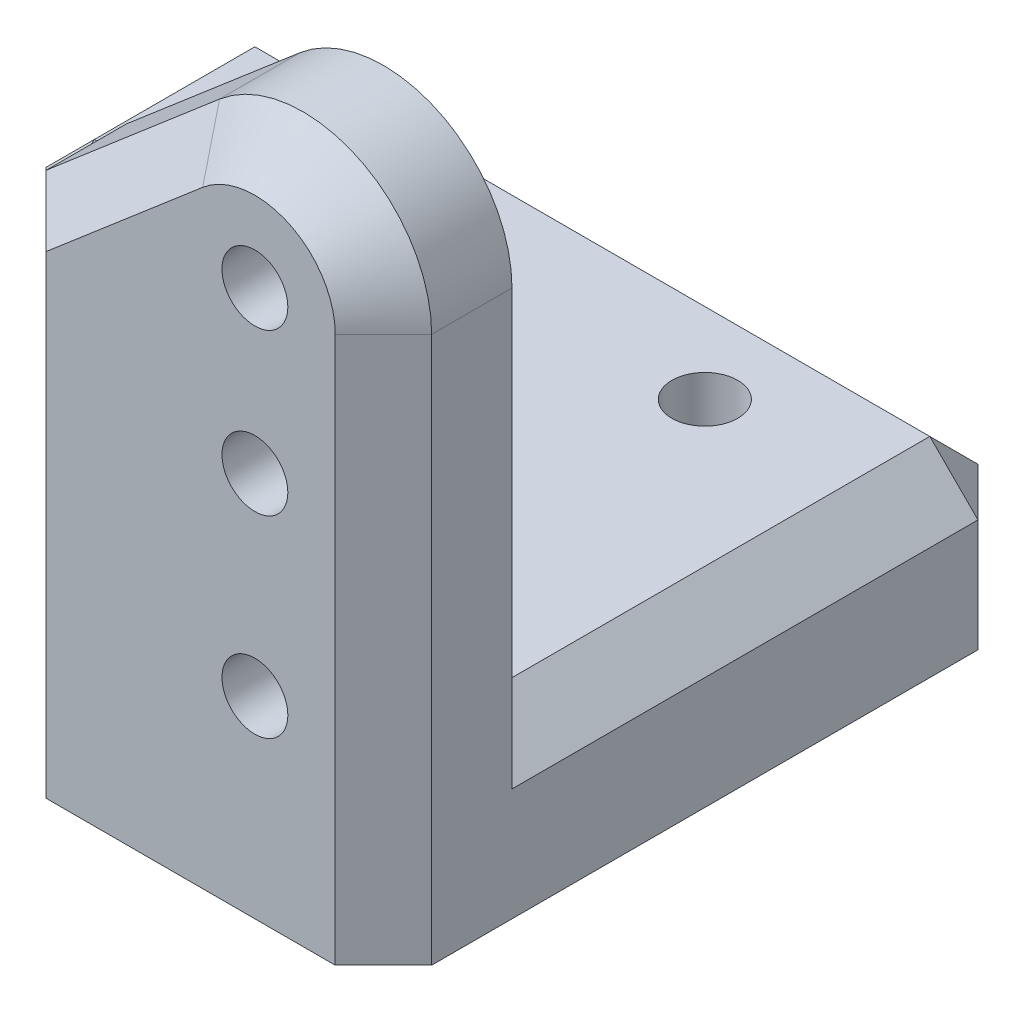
SolidWorks part; units mm, degrees
ref_plane "Plano frontal" through (0, 0, 0) normal (0, 0, 1) x (1, 0, 0)
ref_plane "Plano superior" through (0, 0, 0) normal (0, 1, 0) x (1, 0, 0)
ref_plane "Plano direito" through (0, 0, 0) normal (1, 0, 0) x (0, 0, -1)
sketch "Esboço1" plane through (0, 0, 0) normal (0, 0, 1) x (1, 0, 0)
  line L0 (0, 0) -> (0, 12)
  line L1 (0, 12) -> (9.4001, 20.0398)
  line L4 (16, 17) -> (16, 4)
  line L5 (16, 4) -> (16, 0)
  line L6 (16, 0) -> (0, 0)
  arc A0 (9.4001, 20.0398) -> (16, 17) centre (12, 17) cw
  point P19 (12, 17)
  dimension "D1" = 4
  dimension "D2" = 16
  dimension "D3" = 12
  dimension "D4" = 16
  dimension "D5" = 4
  dimension "D6" = 17
extrude "Ressalto-extrusão1" add sketch "Esboço1" along normal blind 20
sketch "Esboço2" plane through (16, 0, 0) normal (1, 0, 0) x (0, 0, -1)
  line L0 (-20, 0) -> (-20, 5) construction
  line L1 (-20, 5) -> (0, 5) construction
  line L4 (0, 5) -> (-16, 5)
  line L5 (0, 5) -> (0, 21)
  line L6 (0, 21) -> (-16, 21)
  line L7 (-16, 5) -> (-16, 21)
  line L8 (0, 21) -> (-20, 21) construction
  line L9 (0, 0) -> (0, 17) construction
  dimension "D1" = 16
  dimension "D2" = 5
extrude "Corte-extrusão1" cut sketch "Esboço2" against normal blind 20
sketch "Esboço3" plane through (0, 0, 20) normal (0, 0, 1) x (1, 0, 0)
  line L0 (0, 0) -> (4, 0)
  line L1 (0, 0) -> (16, 0) construction
  line L2 (4, 0) -> (4, 15.4212)
  line L3 (9.4001, 20.0398) -> (0, 12) construction
  line L4 (4, 15.4212) -> (0, 12)
  line L5 (0, 12) -> (0, 0)
  dimension "D1" = 4
extrude "Corte-extrusão2" cut sketch "Esboço3" against normal through all
chamfer "Chanfro2" distance 1.5 angle 45 4 edges at (16, 8.5, 20) (13.6734, 20.6332, 20) (6.7, 17.7305, 20) (4, 7.7106, 20)
sketch "Esboço4" plane through (0, 0, 20) normal (0, 0, 1) x (1, 0, 0)
  line L0 (9.4001, 20.0398) -> (12, 17) construction
  point P5 (12, 17)
hole_wizard "Furo roscado de M2.51" positions "3DSketch1" profile "Esboço5" tap size "M2.5" standard "ISO"
sketch3d "3DSketch1"
  point P0 (12, 17, 20)
sketch "Esboço5" plane through (12, 17, 20) normal (1, 0, 0) x (0, -1, 0)
  line L0 (0, 0) -> (0, 20)
  line L1 (0, 20) -> (1.025, 20)
  line L2 (1.025, 20) -> (1.025, 0)
  line L5 (1.025, 0) -> (0, 0)
  line L11 (0, -6.35) -> (0, 107.95) construction
  dimension "Thru Tap Drill Dia." = 2.05
  dimension "Thru Tap Drill Depth" = 20
sketch "Esboço8" plane through (4, 0, 0) normal (-1, 0, 0) x (0, 0, 1)
  line L0 (0, 5) -> (8, 5)
  line L1 (0, 5) -> (16, 5) construction
  line L2 (8, 5) -> (8, 0)
  line L3 (0, 0) -> (18.5, 0) construction
  line L4 (8, 0) -> (0, 0)
  line L5 (0, 0) -> (0, 5)
  dimension "D1" = 8
extrude "Ressalto-extrusão2" add sketch "Esboço8" along normal blind 12
chamfer "Chanfro3" distance 1.5 angle 45 9 edges at (16, 5, 8) (16, 2.5, 0) (4, 5, 0) (-8, 2.5, 0) (-8, 5, 4) (-8, 2.5, 8) (-2, 5, 8) (4, 5, 12) (4, 2.5, 8)
sketch "Esboço9" plane through (0, 0, 0) normal (0, -1, 0) x (1, 0, 0)
  line L0 (10, 20) -> (10, 0) construction
  line L1 (5.5, 20) -> (14.5, 20) construction
  line L2 (-6.5, 0) -> (14.5, 0) construction
  line L3 (-8, 4) -> (10, 4) construction
  line L4 (-8, 1.5) -> (-8, 6.5) construction
  line L5 (10, 4) -> (16, 4) construction
  line L6 (16, 18.5) -> (16, 1.5) construction
  point P10 (10, 14)
  point P15 (4, 4)
  point P16 (-2, 4)
  point P23 (10, 9)
  dimension "D1" = 6
  dimension "D2" = 6
  dimension "D3" = 6
  dimension "D4" = 5
hole_wizard "Furo roscado de M2.52" positions "3DSketch2" profile "Esboço10" tap size "M2.5" standard "ISO"
sketch3d "3DSketch2"
  point P0 (-2, 0, 4)
  point P6 (10, 0, 4)
  point P12 (10, 0, 14)
sketch "Esboço10" plane through (-2, 0, 4) normal (1, 0, 0) x (0, 0, -1)
  line L0 (0, 0) -> (0, 7.8659)
  line L1 (0, 7.8659) -> (1.025, 7.25)
  line L2 (1.025, 7.25) -> (1.025, 0)
  line L5 (1.025, 0) -> (0, 0)
  line L10 (0, 7.8659) -> (-1.025, 7.25) construction
  line L11 (0, -6.35) -> (0, 107.95) construction
  dimension "Tap Drill Dia." = 2.05
  dimension "Tap Drill Depth" = 7.25
  dimension "Drill Angle" = 118
sketch "Esboço11" plane through (0, 0, 20) normal (0, 0, 1) x (1, 0, 0)
  line L0 (16, 17) -> (16, 0) construction
  line L1 (5.5, 0) -> (14.5, 0) construction
  line L2 (12, 6) -> (12, 12) construction
  point P0 (12, 6)
  dimension "D1" = 4
  dimension "D2" = 6
  dimension "D3" = 6
hole_wizard "Broca de rosquear para tarraxa de M2.51" positions "3DSketch3" profile "Esboço12" hole size "M2.5" standard "ISO"
sketch3d "3DSketch3"
  point P0 (12, 6, 20)
  point P3 (12, 12, 20)
sketch "Esboço12" plane through (12, 6, 20) normal (1, 0, 0) x (0, -1, 0)
  line L0 (0, 0) -> (0, 4)
  line L1 (0, 4) -> (1.025, 4)
  line L2 (1.025, 4) -> (1.025, 0)
  line L5 (1.025, 0) -> (0, 0)
  line L11 (0, -6.35) -> (0, 107.95) construction
  dimension "Thru Hole Dia." = 2.05
  dimension "Thru Hole Depth" = 4
